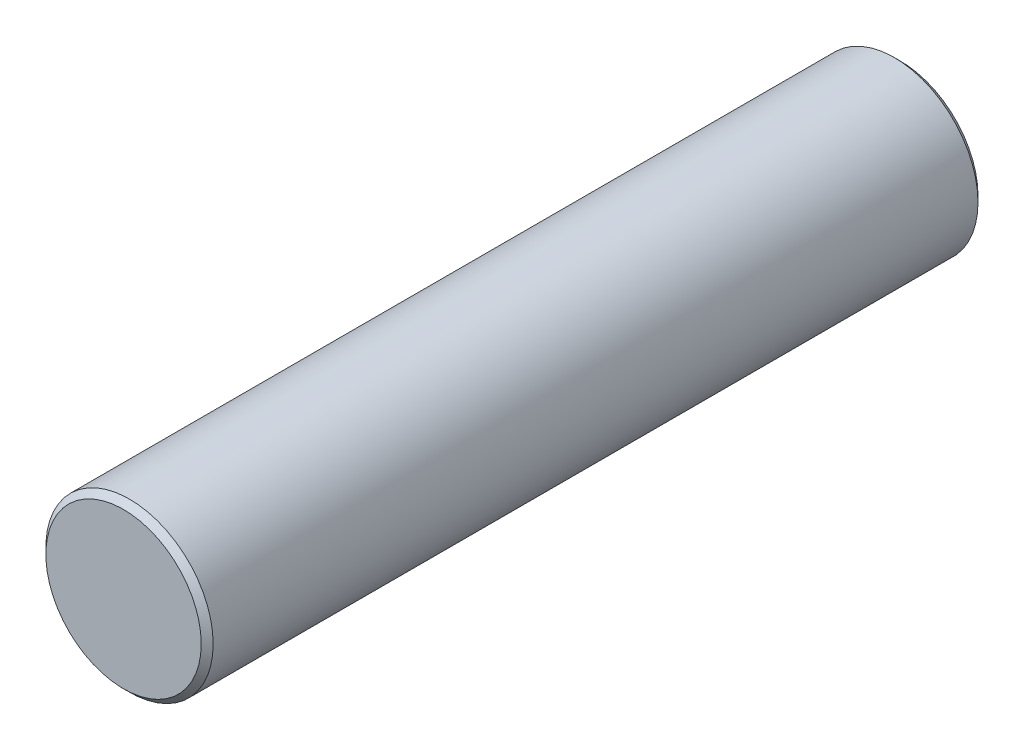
SolidWorks part; units mm, degrees
ref_plane "Front" through (0, 0, 0) normal (0, 0, 1) x (1, 0, 0)
ref_plane "Top" through (0, 0, 0) normal (0, 1, 0) x (1, 0, 0)
ref_plane "Right" through (0, 0, 0) normal (1, 0, 0) x (0, 0, -1)
sketch "Sketch1" plane through (0, 0, 0) normal (0, 0, 1) x (1, 0, 0)
  circle A0 centre (0, 0) radius 7
  dimension "D1" = 14
extrude "Boss-Extrude1" add sketch "Sketch1" along normal mid plane 65
chamfer "Chamfer1" distance 0.5 angle 45 2 edges at (7, 0, -32.5) (7, 0, 32.5)
